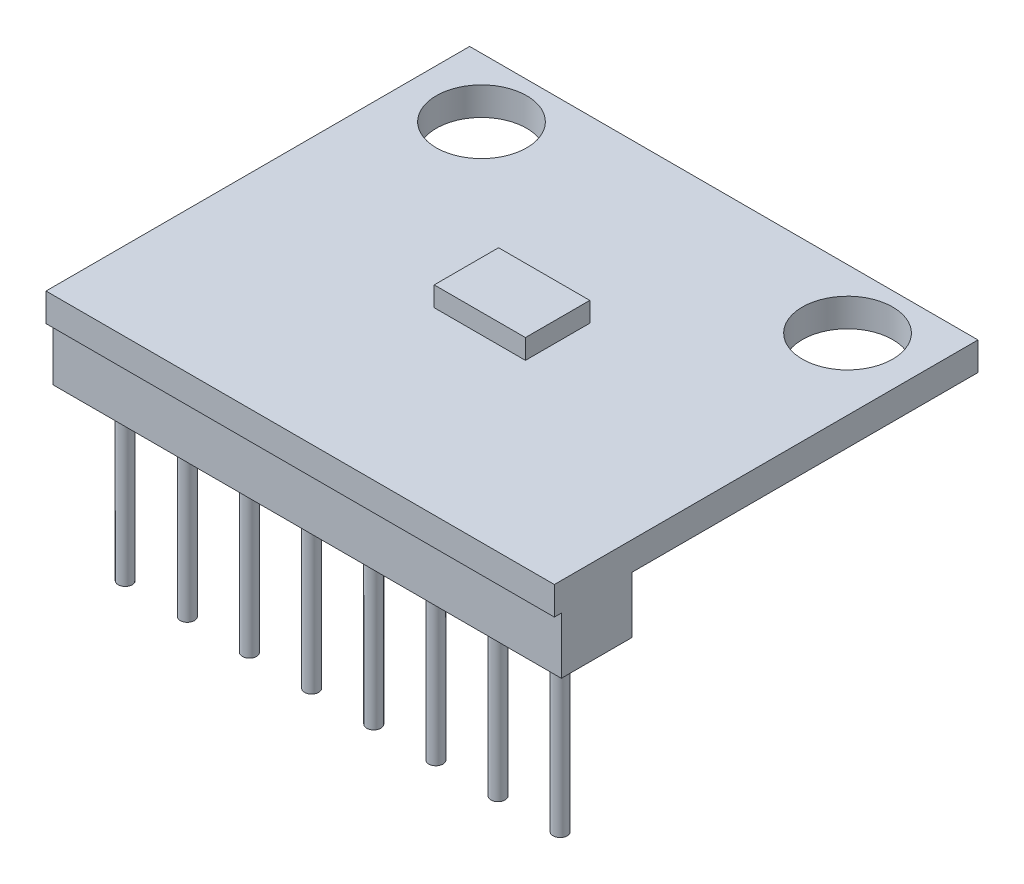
SolidWorks part; units mm, degrees
ref_plane "前视基准面" through (0, 0, 0) normal (0, 0, 1) x (1, 0, 0)
ref_plane "上视基准面" through (0, 0, 0) normal (0, 1, 0) x (1, 0, 0)
ref_plane "右视基准面" through (0, 0, 0) normal (1, 0, 0) x (0, 0, -1)
sketch "草图2" plane through (0, 0, 0) normal (0, 1, 0) x (1, 0, 0)
  line L0 (0, 12.5035) -> (0, -12.6376) construction
  line L1 (-9, 7.5) -> (9, 7.5)
  line L2 (-9, 7.5) -> (-9, -7.5)
  line L3 (-9, -7.5) -> (9, -7.5)
  line L4 (9, 7.5) -> (9, -7.5)
  line L5 (-9, 7.5) -> (9, -7.5) construction
  line L6 (-9, -7.5) -> (9, 7.5) construction
  circle A0 centre (-6.48, 5.4) radius 1.6
  circle A1 centre (6.48, 5.4) radius 1.6
  point P0 (0, 0)
  dimension "D3" = 3.2
  dimension "D1" = 18
  dimension "D2" = 15
  dimension "D4" = 2.1
extrude "凸台-拉伸1" add sketch "草图2" against normal blind 1
sketch "草图3" plane through (0, 0, 0) normal (0, 1, 0) x (1, 0, 0)
  line L1 (-1.6151, 1.1395) -> (1.6151, 1.1395)
  line L2 (-1.6151, 1.1395) -> (-1.6151, -1.1395)
  line L3 (-1.6151, -1.1395) -> (1.6151, -1.1395)
  line L4 (1.6151, 1.1395) -> (1.6151, -1.1395)
  line L5 (-1.6151, 1.1395) -> (1.6151, -1.1395) construction
  line L6 (-1.6151, -1.1395) -> (1.6151, 1.1395) construction
  point P0 (0, 0)
  dimension "D1" = 3.2301
  dimension "D2" = 2.279
extrude "凸台-拉伸2" add sketch "草图3" along normal blind 0.7
sketch "草图4" plane through (0, -1, 0) normal (0, -1, 0) x (1, 0, 0)
  line L0 (0, 8.0125) -> (0, -8.174) construction
  line L1 (-9, 7.5) -> (9, 7.5) construction
  line L2 (-9, 7.2526) -> (9, 7.2526)
  line L3 (-9, 7.2526) -> (-9, 4.7526)
  line L4 (-9, 4.7526) -> (9, 4.7526)
  line L5 (9, 7.2526) -> (9, 4.7526)
  line L6 (-9, 7.2526) -> (9, 4.7526) construction
  line L7 (-9, 4.7526) -> (9, 7.2526) construction
  point P3 (0, 6.0026)
  dimension "D1" = 18
  dimension "D2" = 2.5
  dimension "D3" = 1.4974
extrude "凸台-拉伸3" add sketch "草图4" along normal blind 2
sketch "草图5" plane through (0, -3, 0) normal (0, -1, 0) x (1, 0, 0)
  line L0 (-9, 4.7526) -> (9, 4.7526) construction
  line L1 (-9, 7.2526) -> (-9, 4.7526) construction
  circle A0 centre (-7.7144, 5.9804) radius 0.2507
  circle A1 centre (-5.5144, 5.9804) radius 0.2507
  circle A2 centre (-3.3144, 5.9804) radius 0.2507
  circle A3 centre (-1.1144, 5.9804) radius 0.2507
  circle A4 centre (1.0856, 5.9804) radius 0.2507
  circle A5 centre (3.2856, 5.9804) radius 0.2507
  circle A6 centre (5.4856, 5.9804) radius 0.2507
  circle A7 centre (7.6856, 5.9804) radius 0.2507
  dimension "D3" = 0.5014
  dimension "D1" = 1.2278
  dimension "D2" = 1.2856
  dimension "D4" = 8
extrude "凸台-拉伸4" add sketch "草图5" along normal blind 6
